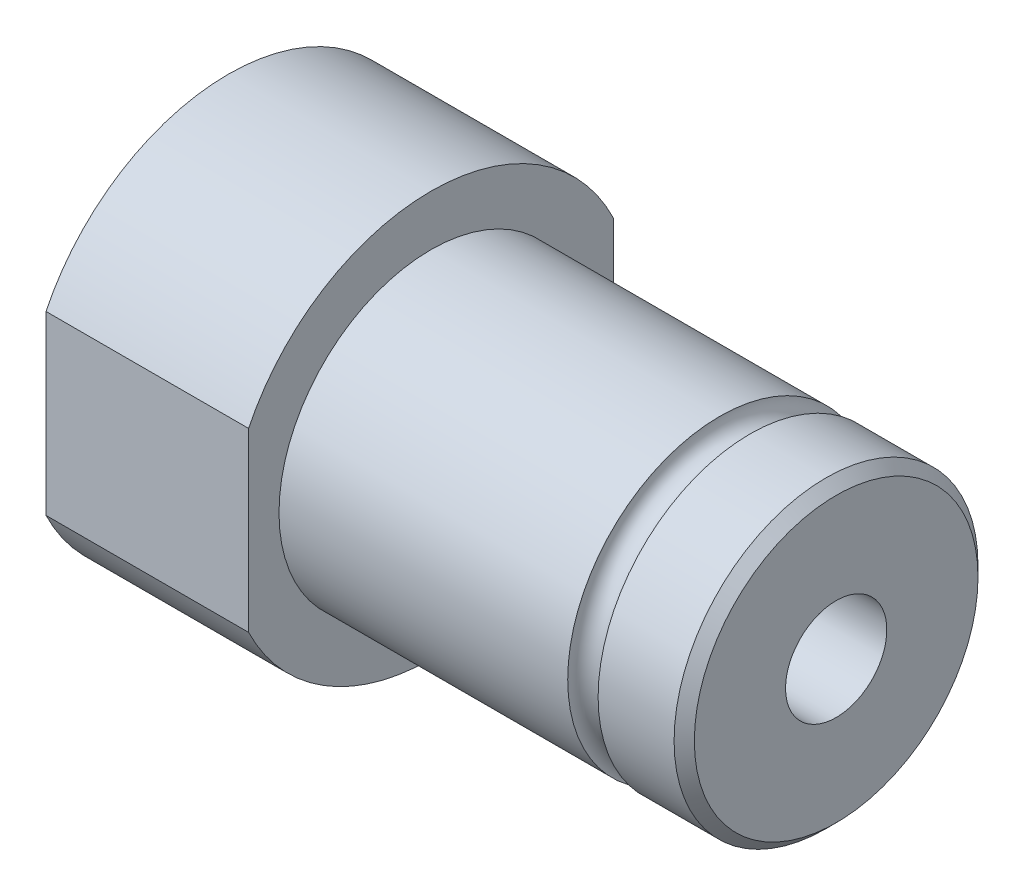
SolidWorks part; units mm, degrees
ref_plane "正面" through (0, 0, 0) normal (0, 0, 1) x (1, 0, 0)
ref_plane "平面" through (0, 0, 0) normal (0, 1, 0) x (1, 0, 0)
ref_plane "右側面" through (0, 0, 0) normal (1, 0, 0) x (0, 0, -1)
sketch "ｽｹｯﾁ1" plane through (0, 0, 0) normal (1, 0, 0) x (0, 0, -1)
  circle A0 centre (0, 0) radius 20
  dimension "D1" = 40
extrude "押し出し1" add sketch "ｽｹｯﾁ1" along normal blind 60
sketch "ｽｹｯﾁ2" plane through (0, 0, 0) normal (-1, 0, 0) x (0, 0, 1)
  circle A0 centre (0, 0) radius 5
  dimension "D1" = 10
extrude "ｶｯﾄ - 押し出し1" cut sketch "ｽｹｯﾁ2" against normal through all
sketch "ｽｹｯﾁ3" plane through (60, 0, 0) normal (1, 0, 0) x (0, 0, -1)
  circle A0 centre (0, 0) radius 15
  dimension "D1" = 30
extrude "ｶｯﾄ - 押し出し2" cut sketch "ｽｹｯﾁ3" against normal blind 40 flip side to cut
sketch "ｽｹｯﾁ4" plane through (0, 0, 0) normal (-1, 0, 0) x (0, 0, 1)
  line L0 (-18, -8.7178) -> (-18, 8.7178)
  line L1 (18, -8.7178) -> (18, 8.7178)
  circle A0 centre (0, 0) radius 20 construction
  arc A1 (18, 8.7178) -> (-18, 8.7178) centre (0, 0) ccw
  arc A2 (-18, -8.7178) -> (18, -8.7178) centre (0, 0) ccw
  dimension "D1" = 36
extrude "ｶｯﾄ - 押し出し3" cut sketch "ｽｹｯﾁ4" against normal through all flip side to cut
sketch "ｽｹｯﾁ5" plane through (0, 0, 0) normal (0, 0, 1) x (1, 0, 0)
  line L0 (60, 15) -> (20, 15) construction
  line L1 (60, -15) -> (60, 15) construction
  line L2 (0, 0) -> (62.2581, 0) construction
  circle A0 centre (50, 15) radius 1.5
  dimension "D1" = 3
  dimension "D2" = 10
revolve "ｶｯﾄ - 回転1" cut sketch "ｽｹｯﾁ5" angle 360 about L2
chamfer "面取り1" distance 1 angle 45 1 edges at (60, 0, -15)
